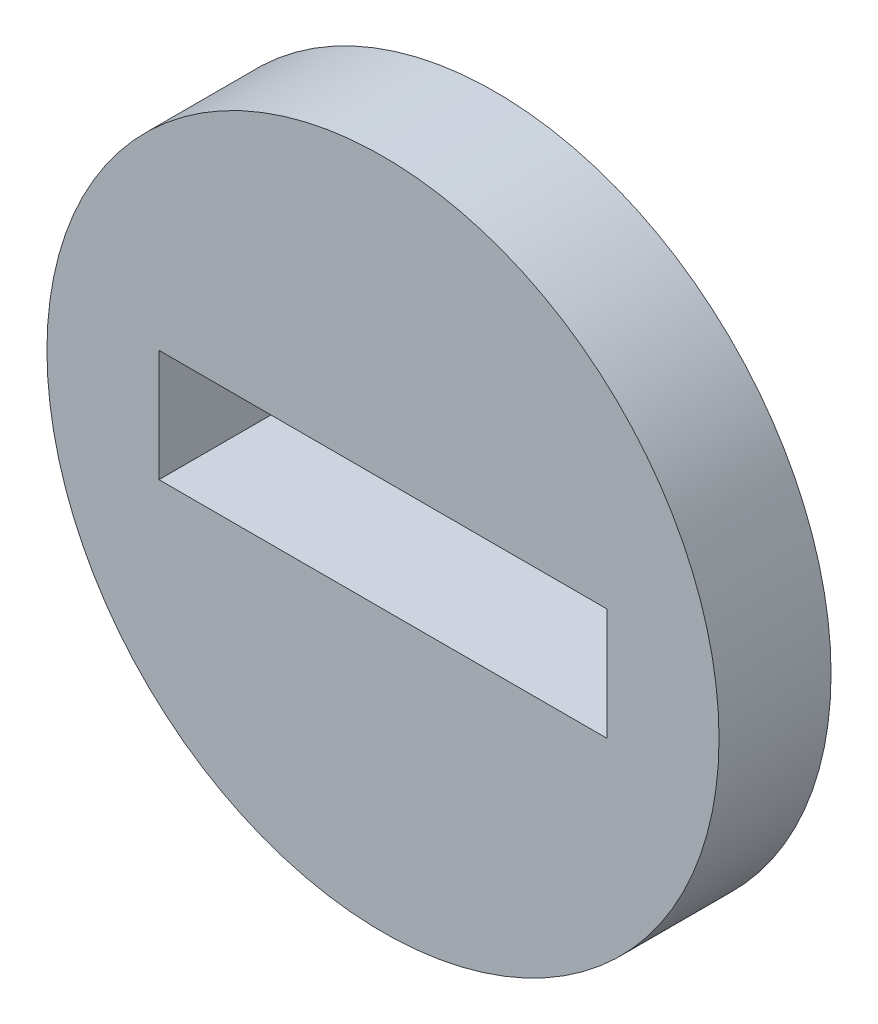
SolidWorks part; units mm, degrees
ref_plane "Front Plane" through (0, 0, 0) normal (0, 0, 1) x (1, 0, 0)
ref_plane "Top Plane" through (0, 0, 0) normal (0, 1, 0) x (1, 0, 0)
ref_plane "Right Plane" through (0, 0, 0) normal (1, 0, 0) x (0, 0, -1)
sketch "Sketch1" plane through (0, 0, 0) normal (0, 0, 1) x (1, 0, 0)
  circle A0 centre (0, 0) radius 19.05
  dimension "D1" = 38.1
extrude "Extrude1" add sketch "Sketch1" along normal blind 6.35
sketch "Sketch2" plane through (0, 0, 6.35) normal (0, 0, 1) x (1, 0, 0)
  line L1 (-12.7, 3.175) -> (12.7, 3.175)
  line L2 (-12.7, 3.175) -> (-12.7, -3.175)
  line L3 (-12.7, -3.175) -> (12.7, -3.175)
  line L4 (12.7, 3.175) -> (12.7, -3.175)
  circle A0 centre (0, 0) radius 19.05 construction
  dimension "D1" = 6.35
  dimension "D2" = 25.4
  dimension "D3" = 12.7
  dimension "D4" = 3.175
extrude "Cut-Extrude1" cut sketch "Sketch2" against normal through all
